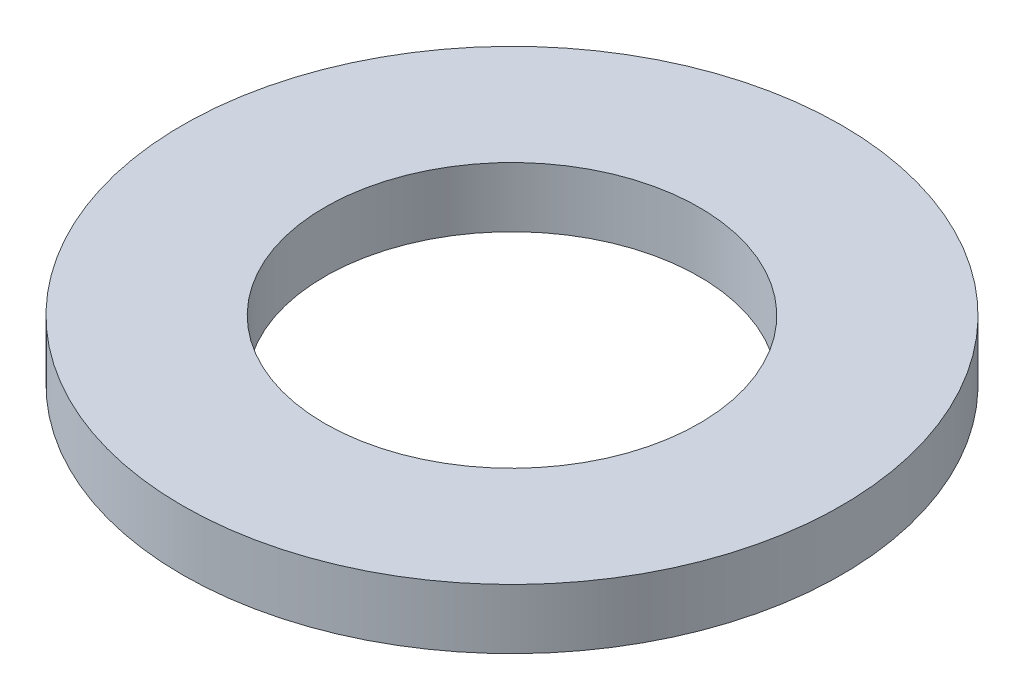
SolidWorks part; units mm, degrees
ref_plane "Front" through (0, 0, 0) normal (0, 0, 1) x (1, 0, 0)
ref_plane "Top" through (0, 0, 0) normal (0, 1, 0) x (1, 0, 0)
ref_plane "Right" through (0, 0, 0) normal (1, 0, 0) x (0, 0, -1)
sketch "Sketch1" plane through (0, 0, 0) normal (0, 1, 0) x (1, 0, 0)
  circle A0 centre (0, 0) radius 12.5
  circle A1 centre (0, 0) radius 22
extrude "Extrude1" add sketch "Sketch1" along normal blind 4
